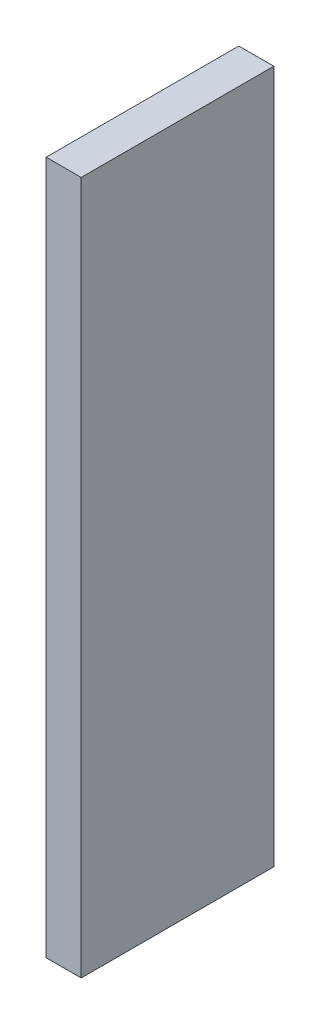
SolidWorks part; units mm, degrees
ref_plane "Front Plane" through (0, 0, 0) normal (0, 0, 1) x (1, 0, 0)
ref_plane "Top Plane" through (0, 0, 0) normal (0, 1, 0) x (1, 0, 0)
ref_plane "Right Plane" through (0, 0, 0) normal (1, 0, 0) x (0, 0, -1)
body saved out of another part "Stock-Track-1"
